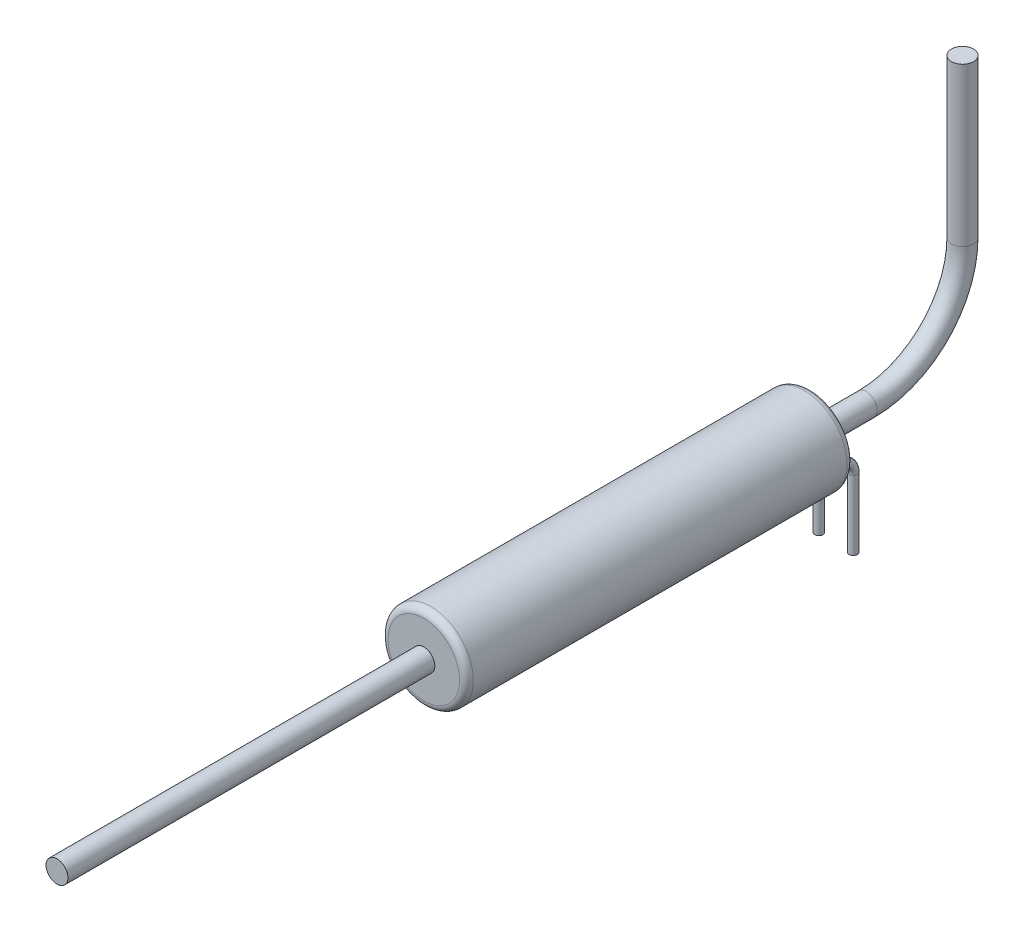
SolidWorks part; units mm, degrees
ref_plane "Front Plane" through (0, 0, 0) normal (0, 0, 1) x (1, 0, 0)
ref_plane "Top Plane" through (0, 0, 0) normal (0, 1, 0) x (1, 0, 0)
ref_plane "Right Plane" through (0, 0, 0) normal (1, 0, 0) x (0, 0, -1)
imported_body "Imported3"
sketch "Sketch1" plane through (0, 7, 0) normal (0, 1, 0) x (-1, 0, 0)
  circle A0 centre (0, -11) radius 0.8
extrude "Boss-Extrude1" add sketch "Sketch1" along normal blind 11.49
sketch "Sketch2" plane through (0, -2.55, 0) normal (0, -1, 0) x (1, 0, 0)
  circle A0 centre (1.25, -1.8) radius 0.3
extrude "Boss-Extrude2" add sketch "Sketch2" along normal blind 5.05
sketch "Sketch3" plane through (0, -2.55, 0) normal (0, -1, 0) x (1, 0, 0)
  circle A0 centre (-1.25, -1.8) radius 0.3
extrude "Boss-Extrude3" add sketch "Sketch3" along normal blind 5.05
sketch "Sketch4" plane through (0, 0, 28.2) normal (0, 0, 1) x (1, 0, 0)
  circle A0 centre (0, 0) radius 0.8
extrude "Boss-Extrude4" add sketch "Sketch4" along normal blind 26.7
fillet "Fillet1" radius 0.5 2 edges at (3.1, 0, 0) (3.1, 0, 28.2)
